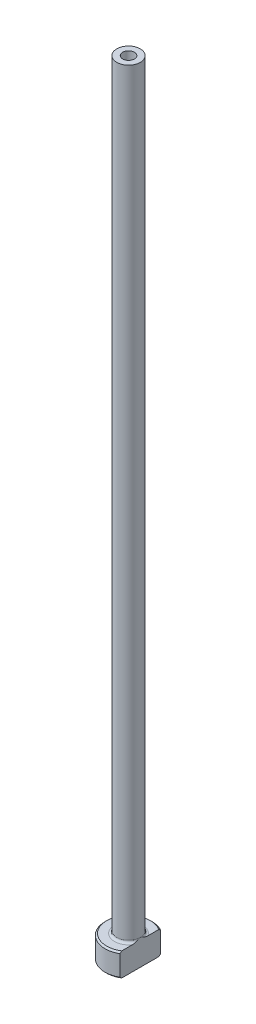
SolidWorks part; units mm, degrees
ref_plane "Front Plane" through (0, 0, 0) normal (0, 0, 1) x (1, 0, 0)
ref_plane "Top Plane" through (0, 0, 0) normal (0, 1, 0) x (1, 0, 0)
ref_plane "Right Plane" through (0, 0, 0) normal (1, 0, 0) x (0, 0, -1)
sketch "Sketch1" plane through (0, 0, 0) normal (0, 0, 1) x (1, 0, 0)
  line L0 (-0.75, 100) -> (-1.5, 100)
  line L1 (-1.5, 100) -> (-1.5, 3)
  line L2 (-1.5, 3) -> (-3, 3)
  line L3 (-3, 3) -> (-3, 0)
  line L4 (4.125, 0) -> (-4.125, 0) construction
  line L5 (-3, 0) -> (-1, 0)
  line L6 (-0.75, 65) -> (-0.75, 100)
  line L7 (0, 92.1877) -> (0, -15.5353) construction
  line L8 (0, -5.5) -> (0, 5.5) construction
  line L9 (-0.75, 65) -> (-1, 53)
  line L10 (-1, 53) -> (-1, 0)
  dimension "D1" = 0.25
  dimension "ID" = 1.5
  dimension "OD" = 3
  dimension "L" = 100
  dimension "H" = 6
  dimension "T" = 3
  dimension "N" = 35
  dimension "D2" = 12
  dimension "L-N" = 65
revolve "Revolve1" add sketch "Sketch1" angle 360 about L7
fillet "Fillet1" radius 0.3 1 edges at (0, 3, 1.5)
chamfer "Chamfer1" distance 0.2 angle 45 2 edges at (0, 3, 3) (0, 0, 3)
sketch "Sketch2" plane through (0, 0, 0) normal (0, -1, 0) x (1, 0, 0)
  line L0 (1.5, 2.5981) -> (1.5, -2.5981)
  circle A0 centre (0, 0) radius 3 construction
  arc A1 (1.5, 2.5981) -> (1.5, -2.5981) centre (0, 0) cw
  circle A2 centre (0, 0) radius 1.5 construction
extrude "Cut-Extrude1" cut sketch "Sketch2" against normal through all
chamfer "Chamfer2" distance 0.5 angle 45 1 edges at (0, 0, 1)
